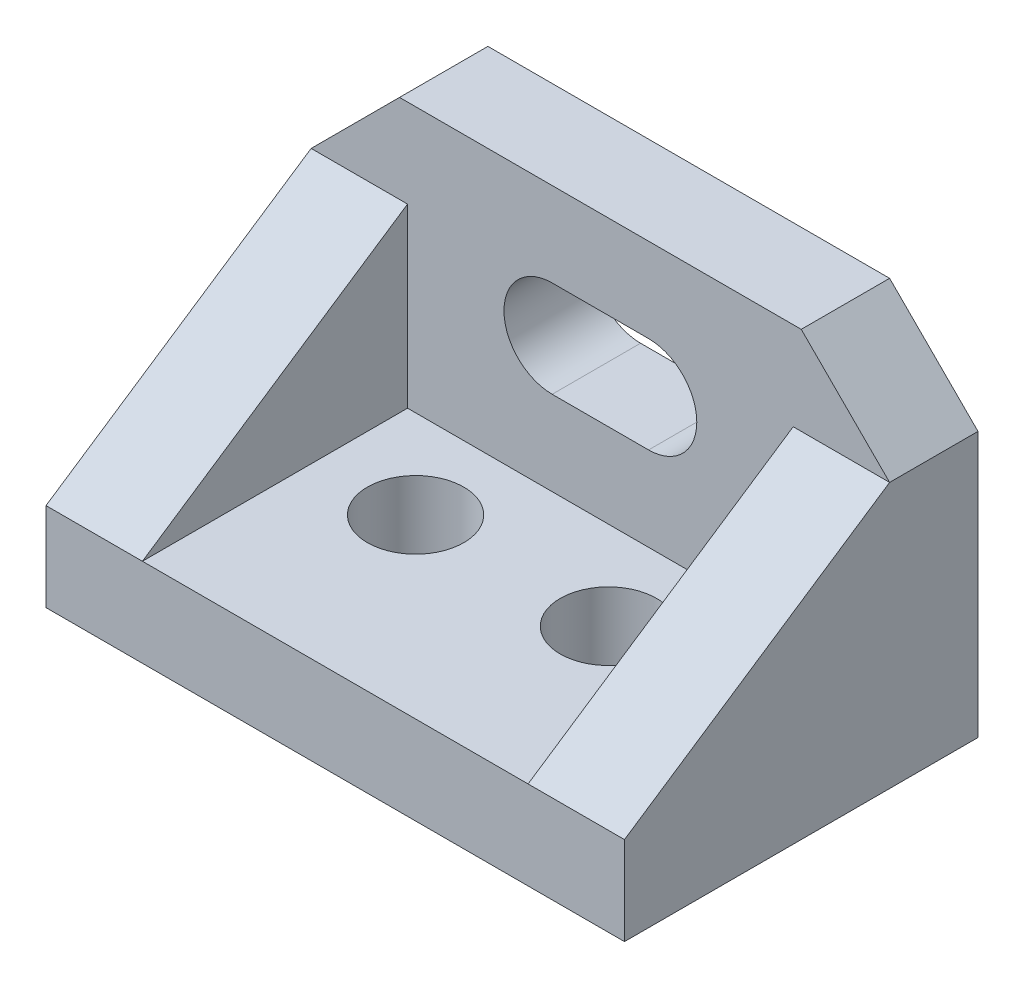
SolidWorks part; units mm, degrees
ref_plane "Front Plane" through (0, 0, 0) normal (0, 0, 1) x (1, 0, 0)
ref_plane "Top Plane" through (0, 0, 0) normal (0, 1, 0) x (1, 0, 0)
ref_plane "Right Plane" through (0, 0, 0) normal (1, 0, 0) x (0, 0, -1)
sketch "Sketch1" plane through (0, 0, 0) normal (1, 0, 0) x (0, 0, -1)
  line L0 (0, 0) -> (0, 34.925)
  line L1 (0, 0) -> (139.7, 0)
  line L4 (139.7, 0) -> (139.7, 139.7)
  line L7 (0, 34.925) -> (104.775, 34.925)
  line L8 (104.775, 34.925) -> (104.775, 139.7)
  line L9 (104.775, 139.7) -> (139.7, 139.7)
extrude "Boss-Extrude1" add sketch "Sketch1" against normal blind 228.6
sketch "Sketch4" plane through (0, 0, 0) normal (1, 0, 0) x (0, 0, -1)
  line L0 (0, 34.925) -> (104.775, 104.775)
  line L1 (104.775, 139.7) -> (104.775, 34.925) construction
  line L2 (139.7, 139.7) -> (104.775, 139.7) construction
  line L3 (104.775, 104.775) -> (104.775, 34.925)
  line L4 (104.775, 34.925) -> (0, 34.925)
extrude "Boss-Extrude2" add sketch "Sketch4" against normal blind 38.1 contours L4 L0 L3
sketch "Sketch5" plane through (-228.6, 0, 0) normal (-1, 0, 0) x (0, 0, 1)
  line L0 (-104.775, 104.775) -> (0, 34.925)
  line L1 (0, 34.925) -> (-104.775, 34.925)
  line L2 (-104.775, 34.925) -> (-104.775, 104.775)
extrude "Boss-Extrude3" add sketch "Sketch5" against normal blind 38.1 contours L2 L0 L1
sketch "Sketch6" plane through (0, 0, -104.775) normal (0, 0, 1) x (1, 0, 0)
  line L0 (0, 104.775) -> (0, 139.7)
  line L1 (0, 139.7) -> (-34.925, 139.7)
  line L2 (-228.6, 139.7) -> (0, 139.7) construction
  line L3 (-34.925, 139.7) -> (0, 104.775)
  line L4 (-114.3, 165.1) -> (-114.3, -17) construction
  line L5 (-228.6, 139.7) -> (-193.675, 139.7)
  line L6 (-228.6, 104.775) -> (-228.6, 139.7)
  line L7 (-193.675, 139.7) -> (-228.6, 104.775)
extrude "Cut-Extrude1" cut sketch "Sketch6" against normal blind 34.925 contours L3 M11 M10 | L5 L7 L6
sketch "Sketch8" plane through (0, 34.925, 0) normal (0, 1, 0) x (1, 0, 0)
  line L0 (-190.5, 0) -> (-38.1, 0) construction
  line L1 (-228.6, 104.775) -> (-228.6, 0) construction
  line L2 (-114.3, 0) -> (-114.3, 104.775) construction
  line L3 (-193.675, 104.775) -> (-34.925, 104.775) construction
  circle A0 centre (-152.4, 69.85) radius 19.05
  circle A1 centre (-76.2, 69.85) radius 19.05
extrude "Cut-Extrude3" cut sketch "Sketch8" against normal up to surface (34.925 mm away) contours A1 | A0
sketch "Sketch11" plane through (0, 0, -104.775) normal (0, 0, 1) x (1, 0, 0)
  line L0 (-133.35, 87.3125) -> (-95.25, 87.3125) construction
  line L1 (-133.35, 106.3625) -> (-95.25, 106.3625)
  line L2 (-133.35, 68.2625) -> (-95.25, 68.2625)
  line L3 (0, 34.925) -> (0, 104.775) construction
  line L4 (-193.675, 139.7) -> (-34.925, 139.7) construction
  arc A0 (-133.35, 106.3625) -> (-133.35, 68.2625) centre (-133.35, 87.3125) ccw
  arc A1 (-95.25, 68.2625) -> (-95.25, 106.3625) centre (-95.25, 87.3125) ccw
  point P2 (-114.3, 87.3125)
  point P11 (-114.3, 139.7)
extrude "Cut-Extrude4" cut sketch "Sketch11" against normal up to surface (34.925 mm away)
equation "\"x\"= 2 / 3 * \"l\" - 0.5"
equation "\"D1@Sketch1\"=\"x\""
equation "\"D2@Sketch1\"=\"x\""
equation "\"D3@Sketch1\"=1/4*\"x\""
equation "\"D4@Sketch1\"=1/4*\"x\""
equation "\"l\"=9"
equation "\"D1@Boss-Extrude1\"=\"l\""
equation "\"D1@Sketch4\"=\"x\"/4"
equation "\"D1@Boss-Extrude2\"=\"l\"/6"
equation "\"D1@Boss-Extrude3\"=\"l\"/6"
equation "\"D1@Cut-Extrude1\"=\"x\"/4"
equation "\"D1@Sketch8\"=\"x\"/2"
equation "\"D2@Sketch8\"=\"l\"/3"
equation "\"D3@Sketch8\"=\"l\"/6"
equation "\"D1@Sketch11\"=5/12*\"l\""
equation "\"D2@Sketch11\"=\"l\"/6"
equation "\"D3@Sketch11\"=3/8*\"x\""
equation "\"D4@Sketch11\"=\"l\"/12"
equation "\"D2@Sketch6\"=\"x\"/4"
